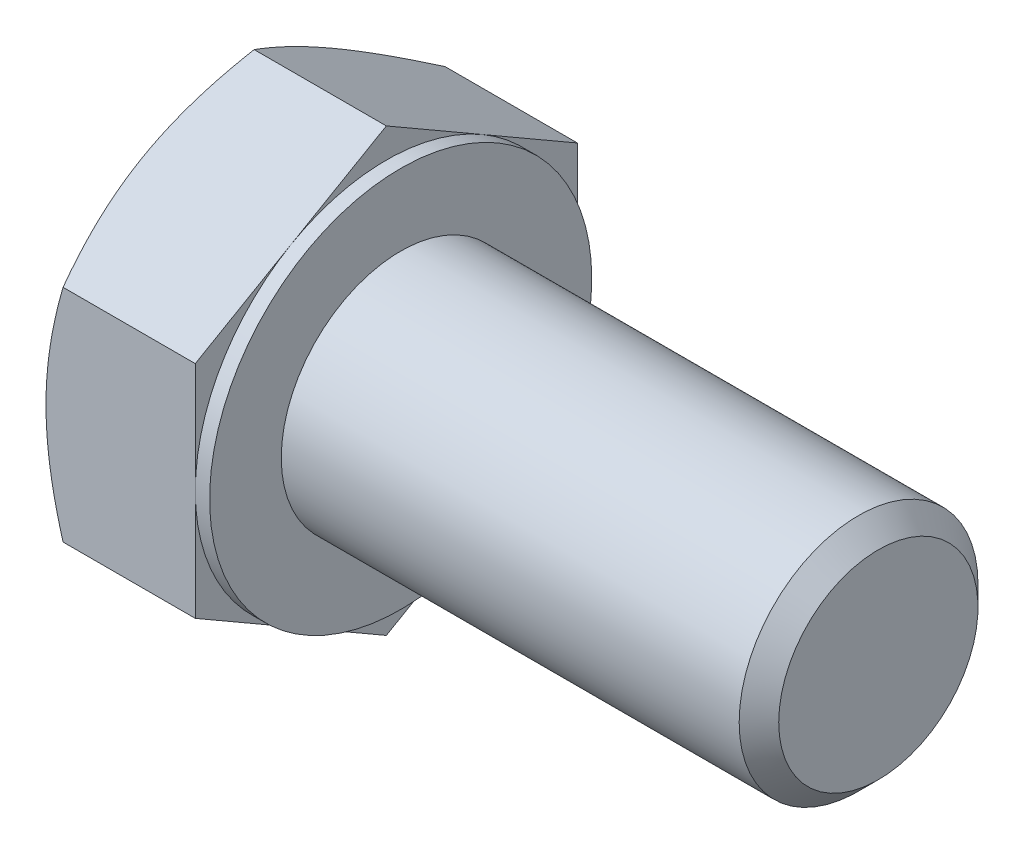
SolidWorks part; units mm, degrees
ref_plane "Plane1" through (0, 0, 0) normal (0, 0, 1) x (1, 0, 0)
ref_plane "Plane2" through (0, 0, 0) normal (0, 1, 0) x (1, 0, 0)
ref_plane "Plane3" through (0, 0, 0) normal (1, 0, 0) x (0, 0, -1)
extrude "BaseHead" add sketch "Sketch1" along normal blind 6.85
sketch "Sketch1" plane through (0, 0, 0) normal (1, 0, 0) x (0, 0, -1)
  line L0 (8, 4.6188) -> (8, -4.6188)
  line L1 (-8, 4.6188) -> (-8, -4.6188)
  line L2 (8, -4.6188) -> (0, -9.2376)
  line L3 (0, -9.2376) -> (-8, -4.6188)
  line L4 (8, 4.6188) -> (0, 9.2376)
  line L5 (0, 9.2376) -> (-8, 4.6188)
  dimension "Width_flats" = 16
  dimension "D2" = 120
  dimension "D3" = 8
  dimension "D4" = 8
  dimension "D5" = 8
revolve "BaseBody" add sketch "BodySke"
sketch "BodySke" plane through (0, 0, 0) normal (0, 0, 1) x (1, 0, 0)
  line L0 (0, 4.6188) -> (0, -4.6188) construction
  line L1 (0, 0) -> (26.85, 0)
  line L2 (0, 0) -> (0, 5)
  line L3 (0, 5) -> (26.022, 5)
  line L4 (26.85, 0) -> (26.85, 4.172)
  line L5 (6.85, 9.2376) -> (6.85, 4.6188) construction
  line L6 (26.85, 4.172) -> (26.022, 5)
  line L7 (0, 0) -> (96.52, 0) construction
  line L8 (26.85, -4.172) -> (26.022, -5) construction
  line L9 (0, -5) -> (26.022, -5) construction
  line L10 (8.35, 15.24) -> (8.35, -1.27) construction
  line L12 (6.85, 4.6188) -> (6.85, -4.6188) construction
  dimension "Length" = 20
  dimension "Body_ch_ang" = 45
  dimension "Diameter" = 10
  dimension "Minor_dia" = 8.344
  dimension "Advance" = 1.5
fillet "HeadFillet" radius 0.4
sketch "Sketch3" plane through (0, 0, 0) normal (0, 0, 1) x (1, 0, 0)
  line L0 (0, 8) -> (3.6013, 14.2376)
  line L1 (0, 9.2376) -> (0, 4.6188) construction
  line L2 (3.6013, 14.2376) -> (3.6013, 19.2376)
  line L3 (3.6013, 19.2376) -> (-10, 19.2376)
  line L4 (-10, 19.2376) -> (-10, 8)
  line L5 (-10, 8) -> (0, 8)
  line L6 (0, 0) -> (99.06, 0) construction
  line L7 (6.85, 9.2376) -> (0, 9.2376) construction
  dimension "D1" = 8
  dimension "D2" = 5
  dimension "D3" = 10
  dimension "D4" = 5
  dimension "Head_ch_ang" = 30
revolve "HeadChamfer" cut sketch "Sketch3" angle 360 about L6
sketch "Sketch4" plane through (0, 0, 0) normal (0, 0, 1) x (1, 0, 0)
  line L1 (6.85, 9.2376) -> (6.85, 4.6188) construction
  line L2 (6.85, 8) -> (6.25, 8)
  line L3 (6.85, 8) -> (6.85, 19.2376)
  line L4 (6.85, 19.2376) -> (6.25, 19.2376)
  line L5 (0, 0) -> (95.25, 0) construction
  line L6 (0, 0) -> (96.52, 0) construction
  line L7 (6.25, 8) -> (6.25, 19.2376)
  line L8 (6.85, 9.2376) -> (0.7145, 9.2376) construction
  dimension "D1" = 16
  dimension "D2" = 10
  dimension "Bearing_ht" = 0.6
revolve "BearingFace" cut sketch "Sketch4" angle 360 about L5
sketch "ThdSchSke" plane through (0, 0, 0) normal (0, 0, 1) x (1, 0, 0)
  line L0 (8.35, -4.172) -> (7.7702, -5)
  line L1 (8.35, -4.172) -> (8.9298, -5)
  line L2 (8.9298, -5) -> (8.9298, -6.25)
  line L3 (-3.175, 0) -> (5.1513, 0) construction
  line L5 (8.9298, -6.25) -> (7.7702, -6.25)
  line L6 (7.7702, -6.25) -> (7.7702, -5)
  dimension "Thread_minor" = 8.344
  dimension "Diameter" = 10
  dimension "Start" = 8.35
  dimension "SideAngle" = 55
  dimension "VeeAngle" = 70
  dimension "Overcut" = 12.5
revolve "ThreadSchematic" cut sketch "ThdSchSke" angle 360 about L3
pattern_linear "ThdSchPat"
equation "\"D3@Sketch1\" = \"Width_flats@Sketch1\" / 2"
equation "\"D4@Sketch1\" = \"D3@Sketch1\""
equation "\"D5@Sketch1\" = \"D4@Sketch1\""
equation "\"Thread_minor@ThreadCosmetic\" = \"Minor_dia@BodySke\""
equation "\"D1@Sketch3\" = \"Width_flats@Sketch1\" / 2"
equation "\"D1@Sketch4\" = \"Width_flats@Sketch1\""
equation "\"Thread_length@ThreadCosmetic\" = \"Length@BodySke\" - \"Advance@BodySke\""
equation "\"Thread_minor@ThdSchSke\" = \"Minor_dia@BodySke\""
equation "\"Diameter@ThdSchSke\" = \"Diameter@BodySke\""
equation "\"Overcut@ThdSchSke\" = \"Diameter@BodySke\" * 1.25"
equation "\"Start@ThdSchSke\" = \"Head_ht@BaseHead\" + \"Length@BodySke\" - \"Thread_length@ThreadCosmetic\"  '---Non-countersunk---"
equation "\"Num_threads@ThdSchPat\" = int( \"Thread_length@ThreadCosmetic\" / \"Advance@BodySke\" + 0.999 )  + 1"
equation "\"Advance@ThdSchPat\" = \"Thread_length@ThreadCosmetic\" /  (\"Num_threads@ThdSchPat\" - 1) 'relax it"
equation "\"Num_threads@ThdSchPat\" = \"Num_threads@ThdSchPat\" - sgn( \"Num_threads@ThdSchPat\" - 1) '---chamfered tips only---"
